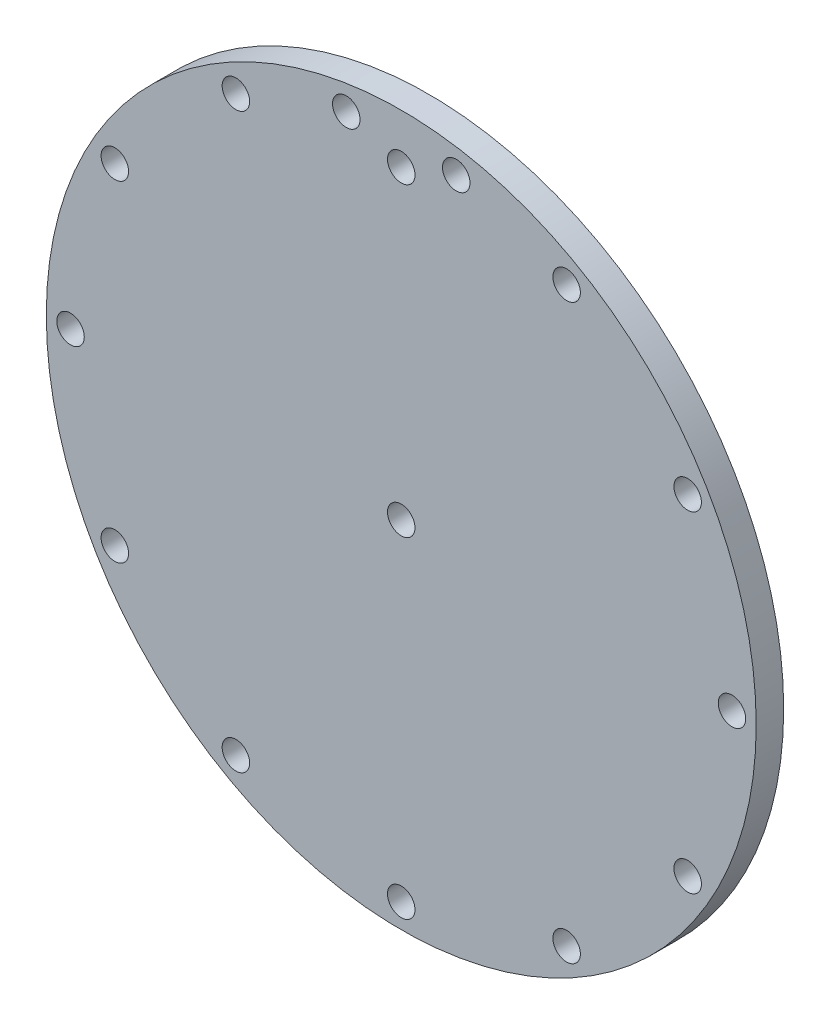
SolidWorks part; units mm, degrees
ref_plane "Front Plane" through (0, 0, 0) normal (0, 0, 1) x (1, 0, 0)
ref_plane "Top Plane" through (0, 0, 0) normal (0, 1, 0) x (1, 0, 0)
ref_plane "Right Plane" through (0, 0, 0) normal (1, 0, 0) x (0, 0, -1)
sketch "Sketch1" plane through (0, 0, 0) normal (0, 0, 1) x (1, 0, 0)
sketch_block_instance "pulley_block_double_cinch-1"
sketch_block "pulley_block_double_cinch"
sketch "Sketch2" plane through (0, 0, 0) normal (0, 0, 1) x (1, 0, 0)
  circle A2 centre (0, 0) radius 41 construction
  circle A3 centre (0, 0) radius 1.5875 construction
  circle A4 centre (-38.2, 0) radius 1.5875 construction
  circle A5 centre (-33.0822, -19.1) radius 1.5875 construction
  circle A6 centre (-19.1, -33.0822) radius 1.5875 construction
  circle A7 centre (0, -38.2) radius 1.5875 construction
  circle A8 centre (19.1, -33.0822) radius 1.5875 construction
  circle A9 centre (33.0822, -19.1) radius 1.5875 construction
  circle A10 centre (38.2, 0) radius 1.5875 construction
  circle A11 centre (-33.0822, 19.1) radius 1.5875 construction
  circle A12 centre (-19.1, 33.0822) radius 1.5875 construction
  circle A13 centre (33.0822, 19.1) radius 1.5875 construction
  circle A14 centre (19.1, 33.0822) radius 1.5875 construction
  circle A15 centre (6.35, 37.6685) radius 1.5875 construction
  circle A16 centre (-6.35, 37.6685) radius 1.5875 construction
  circle A25 centre (0, 0) radius 1.5875
  circle A26 centre (-38.2, 0) radius 1.5875
  circle A27 centre (-33.0822, -19.1) radius 1.5875
  circle A28 centre (-19.1, -33.0822) radius 1.5875
  circle A29 centre (0, -38.2) radius 1.5875
  circle A30 centre (19.1, -33.0822) radius 1.5875
  circle A31 centre (33.0822, -19.1) radius 1.5875
  circle A32 centre (38.2, 0) radius 1.5875
  circle A33 centre (-33.0822, 19.1) radius 1.5875
  circle A34 centre (-19.1, 33.0822) radius 1.5875
  circle A35 centre (33.0822, 19.1) radius 1.5875
  circle A36 centre (19.1, 33.0822) radius 1.5875
  circle A37 centre (6.35, 37.6685) radius 1.5875
  circle A38 centre (-6.35, 37.6685) radius 1.5875
  circle A46 centre (0, 0) radius 41
  circle A47 centre (0, 35.2924) radius 1.5875 construction
  circle A48 centre (0, 35.2924) radius 1.5875
extrude "Boss-Extrude1" add sketch "Sketch2" along normal blind 3.175
other "Move Face1" [suppressed] parameters "D1"=0.0762
other "Move Face2" [suppressed] parameters "D1"=0.2
equation "\"D22@pulley_block_double_cinch\" = \"D3@pulley_block_double_cinch\""
equation "\"D12@pulley_block_double_cinch\" = \"D1@pulley_block_double_cinch\""
equation "\"D25@pulley_block_double_cinch\" =  - \"D21@pulley_block_double_cinch\""
